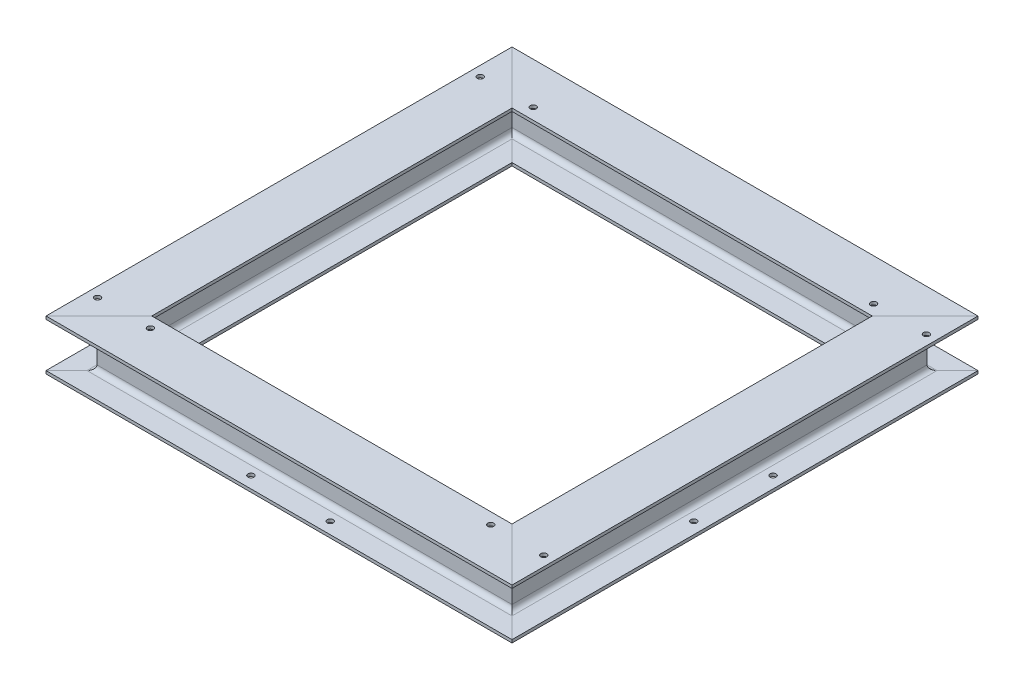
SolidWorks part; units mm, degrees
ref_plane "Plan de face" through (0, 0, 0) normal (0, 0, 1) x (1, 0, 0)
ref_plane "Plan de dessus" through (0, 0, 0) normal (0, 1, 0) x (1, 0, 0)
ref_plane "Plan de droite" through (0, 0, 0) normal (1, 0, 0) x (0, 0, -1)
sketch "Esquisse1" plane through (0, 0, 0) normal (0, 1, 0) x (1, 0, 0)
  line L0 (-625, 625) -> (-625, -625)
  line L5 (625, 625) -> (625, -625)
  line L6 (-625, 0) -> (625, 0) construction
  line L7 (-504.1115, 625) -> (504.1115, 625)
  line L8 (-438.8043, -625) -> (569.4186, -625)
  point P7 (0, 0)
  point P13 (0, 625)
  dimension "D1" = 1250
  dimension "D2" = 1250
other "Hea série économique HE 160 A(1)"
ref_plane "Plan2" through (-625, 0, -625) normal (0, 0, 1) x (1, 0, 0)
sketch "Esquisse12" plane through (-625, 0, -625) normal (0, 0, 1) x (1, 0, 0)
  line L0 (-80, 76) -> (80, 76)
  line L1 (80, 76) -> (80, 67)
  line L2 (80, 67) -> (18, 67)
  line L3 (3, 52) -> (3, -52)
  line L4 (18, -67) -> (80, -67)
  line L5 (80, -67) -> (80, -76)
  line L6 (80, -76) -> (-80, -76)
  line L7 (-80, -76) -> (-80, -67)
  line L8 (-80, -67) -> (-18, -67)
  line L9 (-3, -52) -> (-3, 52)
  line L10 (-18, 67) -> (-80, 67)
  line L11 (-80, 67) -> (-80, 76)
  line L12 (0, 76) -> (0, -76) construction
  arc A0 (-3, 52) -> (-18, 67) centre (-18, 52) ccw
  arc A1 (3, 52) -> (18, 67) centre (18, 52) cw
  arc A2 (3, -52) -> (18, -67) centre (18, -52) ccw
  arc A3 (-18, -67) -> (-3, -52) centre (-18, -52) ccw
  point P23 (0, 0)
  dimension "D5" = 15
  dimension "D1" = 152
  dimension "D2" = 160
  dimension "D3" = 6
  dimension "D4" = 9
other "Ajuster/Prolonger1"
other "Ajuster/Prolonger2"
other "Ajuster/Prolonger3"
other "Ajuster/Prolonger4"
sketch "Esquisse13" plane through (0, 76, 0) normal (0, 1, 0) x (1, 0, 0)
  line L0 (705, 705) -> (-705, 705) construction
  line L1 (705, -705) -> (705, 705) construction
  circle A0 centre (515, 579) radius 9
  circle A1 centre (675, 579) radius 9
  dimension "D1" = 18
  dimension "D2" = 160
  dimension "D3" = 126
  dimension "D4" = 30
extrude "Enlèv. mat.-Extru.1" cut sketch "Esquisse13" against normal blind 10
mirror "Symétrie1" about plane through (0, 0, 0) normal (1, 0, 0) of "Enlèv. mat.-Extru.1"
mirror "Symétrie2" about plane through (0, 0, 0) normal (0, 0, 1) of "Symétrie1", "Enlèv. mat.-Extru.1"
sketch "Esquisse14" plane through (0, -76, 0) normal (0, -1, 0) x (-1, 0, 0)
  circle A2 centre (120, -670) radius 9
  circle A3 centre (-120, -670) radius 9
  circle A4 centre (0, 0) radius 100.86 construction
  circle A5 centre (-670, 120) radius 9
  circle A6 centre (-670, -120) radius 9
  circle A7 centre (120, 670) radius 9
  circle A8 centre (-120, 670) radius 9
  circle A9 centre (670, -120) radius 9
  circle A10 centre (670, 120) radius 9
  point P22 (0, 0)
  dimension "D1" = 4
extrude "Enlèv. mat.-Extru.2" cut sketch "Esquisse14" against normal blind 10
